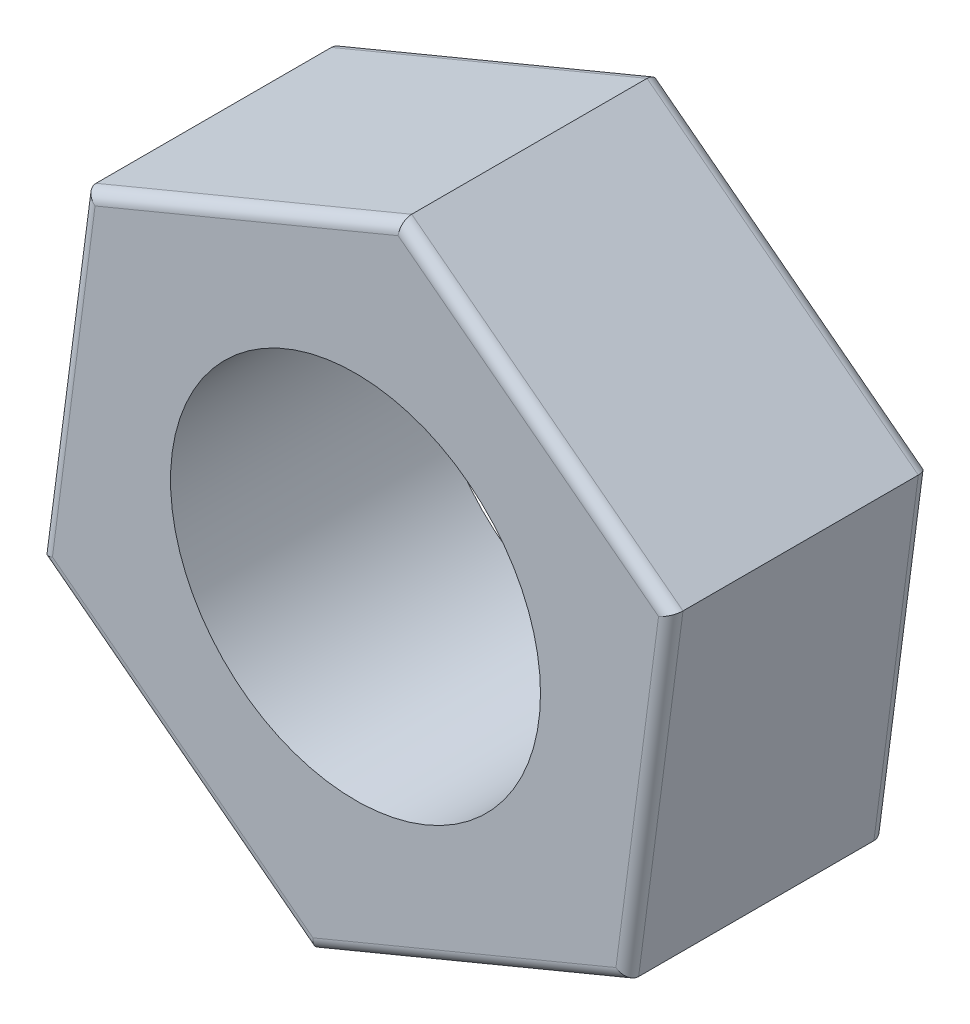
SolidWorks part; units mm, degrees
ref_plane "Front Plane" through (0, 0, 0) normal (0, 0, 1) x (1, 0, 0)
ref_plane "Top Plane" through (0, 0, 0) normal (0, 1, 0) x (1, 0, 0)
ref_plane "Right Plane" through (0, 0, 0) normal (1, 0, 0) x (0, 0, -1)
sketch "Sketch1" plane through (0, 0, 0) normal (0, 0, 1) x (1, 0, 0)
  line L1 (5.8202, -4.4596) -> (6.7723, 2.8106)
  line L2 (6.7723, 2.8106) -> (0.9521, 7.2703)
  line L3 (0.9521, 7.2703) -> (-5.8202, 4.4596)
  line L4 (-5.8202, 4.4596) -> (-6.7723, -2.8106)
  line L5 (-6.7723, -2.8106) -> (-0.9521, -7.2703)
  line L6 (-0.9521, -7.2703) -> (5.8202, -4.4596)
  circle A0 centre (0, 0) radius 6.35 construction
  circle A1 centre (0, 0) radius 3.9688
  dimension "D2" = 7.9375
  dimension "D1" = 12.7
extrude "Boss-Extrude1" add sketch "Sketch1" along normal blind 5.5562
fillet "Fillet1" radius 0.254 12 edges at (6.2962, -0.8245, 0) (2.4341, -5.865, 0) (-3.8622, -5.0405, 0) (-6.2962, 0.8245, 0) (-2.4341, 5.865, 0) (3.8622, 5.0405, 0) (6.2962, -0.8245, 5.5562) (2.4341, -5.865, 5.5562) (-3.8622, -5.0405, 5.5562) (-6.2962, 0.8245, 5.5562) (-2.4341, 5.865, 5.5562) (3.8622, 5.0405, 5.5562)
